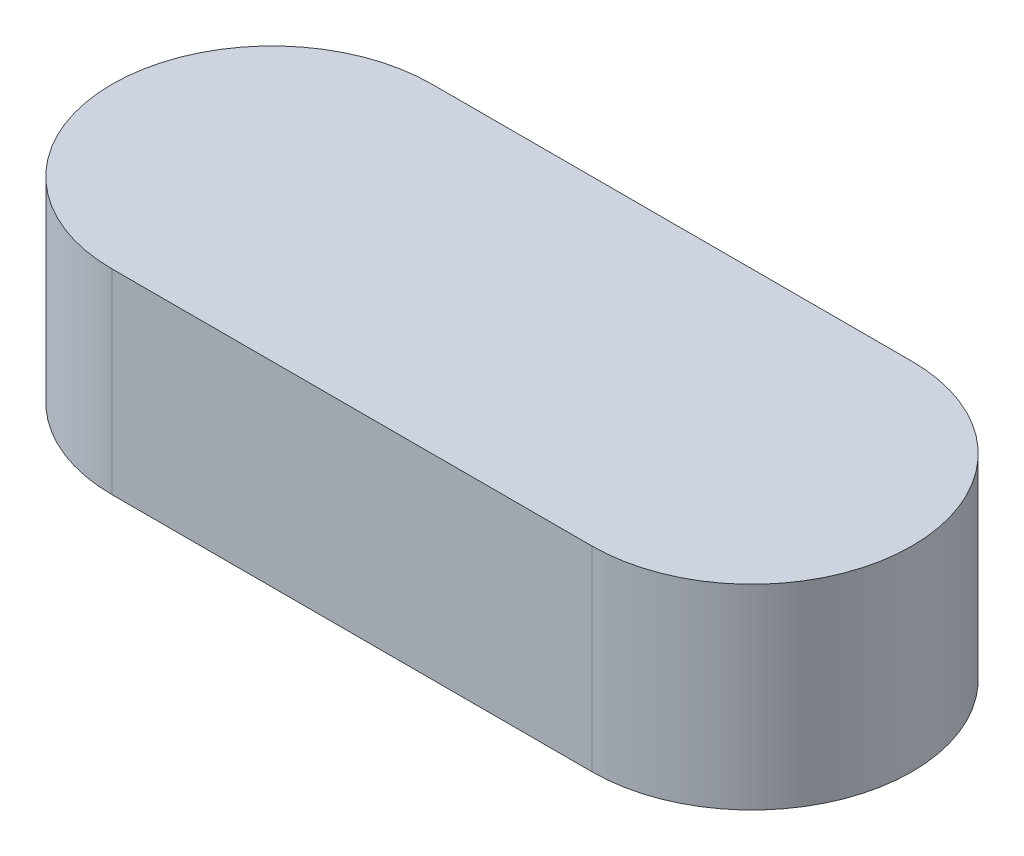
SolidWorks part; units mm, degrees
ref_plane "Спереди" through (0, 0, 0) normal (0, 0, 1) x (1, 0, 0)
ref_plane "Сверху" through (0, 0, 0) normal (0, 1, 0) x (1, 0, 0)
ref_plane "Справа" through (0, 0, 0) normal (1, 0, 0) x (0, 0, -1)
sketch "Sketch1" plane through (0, 0, 0) normal (0, 1, 0) x (1, 0, 0)
  line L0 (107.7099, 0) -> (-89.2202, 0) construction
  line L1 (27, 9) -> (0, 9)
  line L2 (0, -9) -> (27, -9)
  arc A0 (0, 9) -> (0, -9) centre (0, 0) ccw
  arc A1 (27, -9) -> (27, 9) centre (27, 0) ccw
  point P4 (-9, 0)
  point P6 (36, 0)
  dimension "D1" = 9
  dimension "D2" = 45
extrude "Extrude1" add sketch "Sketch1" along normal blind 11
